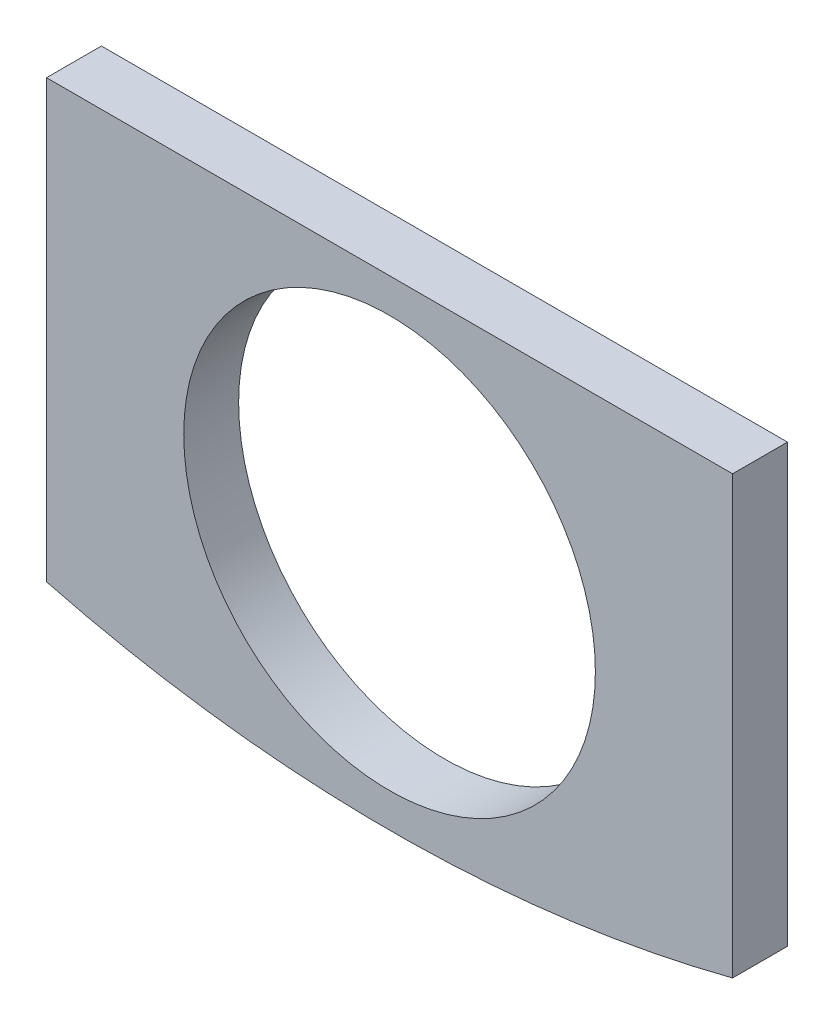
SolidWorks part; units mm, degrees
ref_plane "Front" through (0, 0, 0) normal (0, 0, 1) x (1, 0, 0)
ref_plane "Top" through (0, 0, 0) normal (0, 1, 0) x (1, 0, 0)
ref_plane "Right" through (0, 0, 0) normal (1, 0, 0) x (0, 0, -1)
sketch "Sketch1" plane through (0, 0, 0) normal (0, 0, 1) x (1, 0, 0)
  line L0 (0, 677.5056) -> (0, 791.8091) construction
  line L1 (-25, 3.1754) -> (-25, 35)
  line L2 (-25, 35) -> (25, 35)
  line L3 (0, -13.9368) -> (0, 43.4583) construction
  line L4 (25, 3.1754) -> (25, 35)
  line L5 (-83.1792, 0) -> (106.3024, 0) construction
  arc A0 (-25, 3.1754) -> (25, 3.1754) centre (0, 100) ccw
  dimension "D3" = 100
  dimension "D1" = 50
  dimension "D2" = 35
extrude "Base-Extrude" add sketch "Sketch1" along normal blind 4
sketch "Sketch3" plane through (0, 0, 4) normal (0, 0, 1) x (1, 0, 0)
  line L0 (0, 41.8279) -> (0, -17.6644) construction
  line L1 (25, 35) -> (-25, 35) construction
  circle A0 centre (0, 17.5) radius 15
  dimension "D1" = 30
  dimension "D2" = 17.5
extrude "Cut-Extrude1" cut sketch "Sketch3" against normal through all
